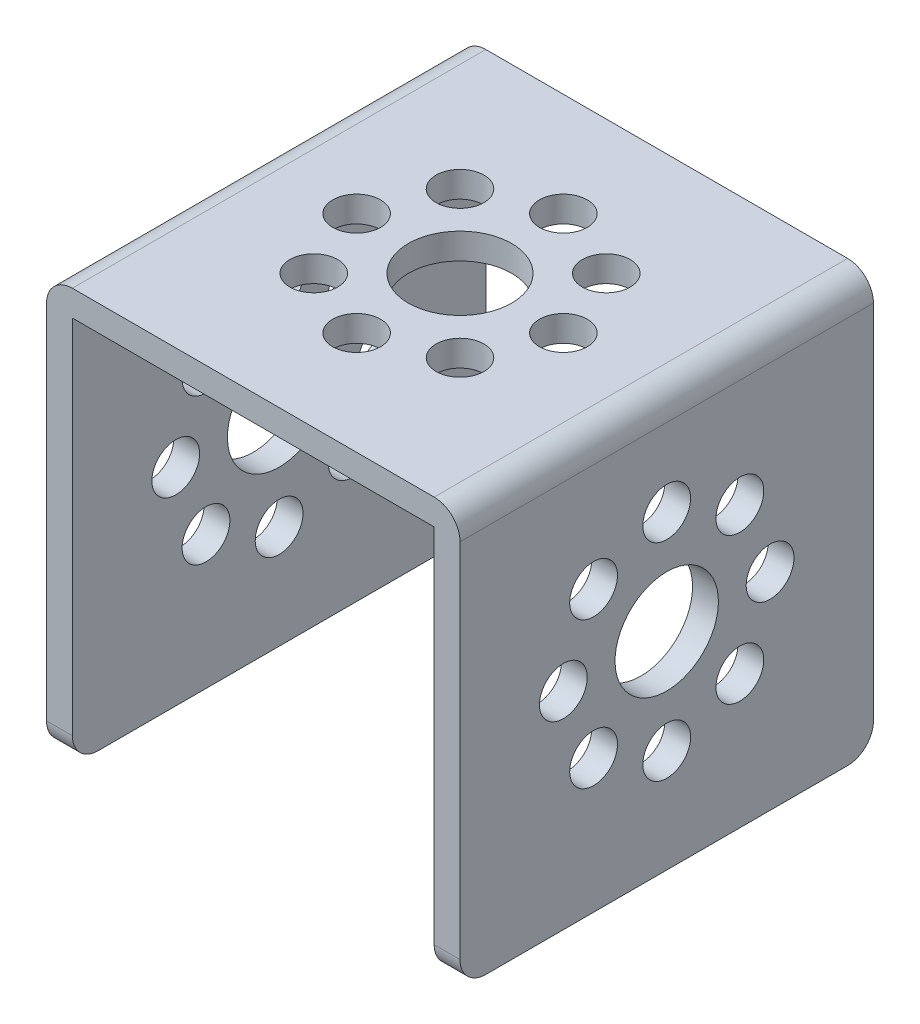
SolidWorks part; units mm, degrees
ref_plane "Front Plane" through (0, 0, 0) normal (0, 0, 1) x (1, 0, 0)
ref_plane "Top Plane" through (0, 0, 0) normal (0, 1, 0) x (1, 0, 0)
ref_plane "Right Plane" through (0, 0, 0) normal (1, 0, 0) x (0, 0, -1)
sketch "Sketch1" plane through (0, 0, 0) normal (0, 0, 1) x (1, 0, 0)
  line L0 (14, -16) -> (16, -16)
  line L1 (-16, 16) -> (16, 16)
  line L2 (-16, 16) -> (-16, -16)
  line L3 (-16, -16) -> (-14, -16)
  line L4 (16, 16) -> (16, -16)
  line L5 (-16, 16) -> (16, -16) construction
  line L6 (-16, -16) -> (16, 16) construction
  line L7 (-14, 14) -> (14, 14)
  line L8 (-14, 14) -> (-14, -16)
  line L10 (14, 14) -> (14, -16)
  point P0 (0, 0)
  dimension "D1" = 32
  dimension "D2" = 32
  dimension "D3" = 2
  dimension "D4" = 2
extrude "Boss-Extrude1" add sketch "Sketch1" against normal blind 32
sketch "Sketch2" plane through (0, 16, 0) normal (0, 1, 0) x (1, 0, 0)
  line L0 (0, 0) -> (0, 165.6972) construction
  line L1 (16, 0) -> (-16, 0) construction
  line L2 (-22.6814, 16) -> (33.3444, 16) construction
  circle B0 centre (8, 16) radius 1.85
  circle B1 centre (0, 8) radius 1.85
  circle B2 centre (0, 16) radius 4
  circle B3 centre (0, 24) radius 1.85
  circle B4 centre (-5.66, 21.66) radius 1.85
  circle B5 centre (-5.66, 10.34) radius 1.85
  circle B6 centre (-8, 16) radius 1.85
  circle B7 centre (5.66, 21.66) radius 1.85
  circle B8 centre (5.66, 10.34) radius 1.85
sketch_block_instance "TETRIX 8 hole Pattern-1"
sketch_block "TETRIX 8 hole Pattern"
extrude "Cut-Extrude1" cut sketch "Sketch2" against normal through all
sketch "Sketch3" plane through (16, 0, 0) normal (1, 0, 0) x (0, 0, -1)
  line L0 (-3.4954, 0) -> (176.3323, 0) construction
  line L1 (16, 20.0815) -> (16, -27.7006) construction
  circle B0 centre (24, 0) radius 1.85
  circle B1 centre (16, -8) radius 1.85
  circle B2 centre (16, 0) radius 4
  circle B3 centre (16, 8) radius 1.85
  circle B4 centre (10.34, 5.66) radius 1.85
  circle B5 centre (10.34, -5.66) radius 1.85
  circle B6 centre (8, 0) radius 1.85
  circle B7 centre (21.66, 5.66) radius 1.85
  circle B8 centre (21.66, -5.66) radius 1.85
sketch_block_instance "TETRIX 8 hole Pattern-3"
extrude "Cut-Extrude2" cut sketch "Sketch3" against normal through all
fillet "Fillet1" radius 2 6 edges at (-15, -16, -32) (15, -16, -32) (-15, -16, 0) (15, -16, 0) (-16, 16, -16) (16, 16, -16)
